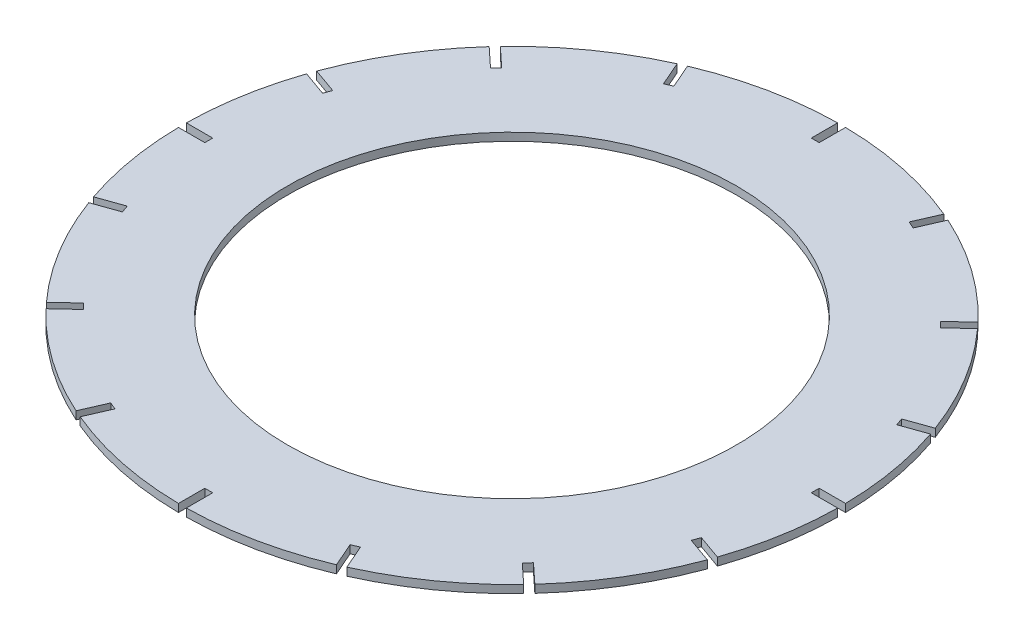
SolidWorks part; units mm, degrees
ref_plane "Front Plane" through (0, 0, 0) normal (0, 0, 1) x (1, 0, 0)
ref_plane "Top Plane" through (0, 0, 0) normal (0, 1, 0) x (1, 0, 0)
ref_plane "Right Plane" through (0, 0, 0) normal (1, 0, 0) x (0, 0, -1)
sketch "Sketch2" plane through (0, 0, 0) normal (0, 1, 0) x (1, 0, 0)
  line L0 (125, 0) -> (124.991, 0) construction
  line L1 (0, 125) -> (0, 124.991) construction
  line L2 (114.991, 1.5) -> (114.991, -1.5)
  line L3 (-124.991, 1.5) -> (-114.991, 1.5)
  line L5 (-124.991, -1.5) -> (-114.991, -1.5)
  line L6 (-114.991, 1.5) -> (-114.991, -1.5)
  line L7 (124.991, -1.5) -> (114.991, -1.5)
  line L9 (124.991, 1.5) -> (114.991, 1.5)
  line L23 (-117.2882, 43.2258) -> (-107.8644, 39.8805)
  line L24 (-118.2918, 40.3986) -> (-108.8679, 37.0534)
  line L25 (-107.8644, 39.8805) -> (-108.8679, 37.0534)
  line L26 (1.5, -124.991) -> (1.5, -114.991)
  line L28 (-1.5, 124.991) -> (-1.5, 114.991)
  line L29 (-1.5, 114.991) -> (1.5, 114.991)
  line L30 (1.5, 124.991) -> (1.5, 114.991)
  line L31 (-1.5, -114.991) -> (1.5, -114.991)
  line L32 (-1.5, -124.991) -> (-1.5, -114.991)
  line L35 (-90.574, 86.1473) -> (-83.2459, 79.3429)
  line L36 (-92.6153, 83.9488) -> (-85.2872, 77.1445)
  line L37 (-83.2459, 79.3429) -> (-85.2872, 77.1445)
  line L39 (-48.5996, 115.1655) -> (-44.6013, 105.9995)
  line L40 (-51.3493, 113.966) -> (-47.3511, 104.8001)
  line L41 (-44.6013, 105.9995) -> (-47.3511, 104.8001)
  line L42 (44.6013, 105.9995) -> (47.3511, 104.8001)
  line L43 (51.3493, 113.966) -> (47.3511, 104.8001)
  line L44 (48.5996, 115.1655) -> (44.6013, 105.9995)
  line L46 (83.2459, 79.3429) -> (85.2872, 77.1445)
  line L47 (92.6153, 83.9488) -> (85.2872, 77.1445)
  line L48 (90.574, 86.1473) -> (83.2459, 79.3429)
  line L50 (107.8644, 39.8805) -> (108.8679, 37.0534)
  line L51 (118.2918, 40.3986) -> (108.8679, 37.0534)
  line L52 (117.2882, 43.2258) -> (107.8644, 39.8805)
  line L55 (117.2882, -43.2258) -> (107.8644, -39.8805)
  line L56 (118.2918, -40.3986) -> (108.8679, -37.0534)
  line L57 (107.8644, -39.8805) -> (108.8679, -37.0534)
  line L59 (90.574, -86.1473) -> (83.2459, -79.3429)
  line L60 (92.6153, -83.9488) -> (85.2872, -77.1445)
  line L61 (83.2459, -79.3429) -> (85.2872, -77.1445)
  line L63 (48.5996, -115.1655) -> (44.6013, -105.9995)
  line L64 (51.3493, -113.966) -> (47.3511, -104.8001)
  line L65 (44.6013, -105.9995) -> (47.3511, -104.8001)
  line L66 (-44.6013, -105.9995) -> (-47.3511, -104.8001)
  line L67 (-51.3493, -113.966) -> (-47.3511, -104.8001)
  line L68 (-48.5996, -115.1655) -> (-44.6013, -105.9995)
  line L70 (-83.2459, -79.3429) -> (-85.2872, -77.1445)
  line L71 (-92.6153, -83.9488) -> (-85.2872, -77.1445)
  line L72 (-90.574, -86.1473) -> (-83.2459, -79.3429)
  line L74 (-107.8644, -39.8805) -> (-108.8679, -37.0534)
  line L75 (-118.2918, -40.3986) -> (-108.8679, -37.0534)
  line L76 (-117.2882, -43.2258) -> (-107.8644, -39.8805)
  line L78 (-124.991, 0) -> (-126.346, 0) construction
  line L79 (0, -114.991) -> (0, -125) construction
  arc A0 (-48.5996, -115.1655) -> (-1.5, -124.991) centre (0, 0) ccw
  arc A1 (-90.574, -86.1473) -> (-51.3493, -113.966) centre (0, 0) ccw
  arc A2 (-117.2882, -43.2258) -> (-92.6153, -83.9488) centre (0, 0) ccw
  arc A3 (-124.991, -1.5) -> (-118.2918, -40.3986) centre (0, 0) ccw
  arc A4 (-118.2918, 40.3986) -> (-124.991, 1.5) centre (0, 0) ccw
  arc A5 (-92.6153, 83.9488) -> (-117.2882, 43.2258) centre (0, 0) ccw
  arc A6 (-51.3493, 113.966) -> (-90.574, 86.1473) centre (0, 0) ccw
  arc A7 (-1.5, 124.991) -> (-48.5996, 115.1655) centre (0, 0) ccw
  arc A8 (48.5996, 115.1655) -> (1.5, 124.991) centre (0, 0) ccw
  arc A9 (90.574, 86.1473) -> (51.3493, 113.966) centre (0, 0) ccw
  arc A10 (117.2882, 43.2258) -> (92.6153, 83.9488) centre (0, 0) ccw
  arc A11 (124.991, 1.5) -> (118.2918, 40.3986) centre (0, 0) ccw
  arc A12 (1.5, -124.991) -> (48.5996, -115.1655) centre (0, 0) ccw
  arc A13 (51.3493, -113.966) -> (90.574, -86.1473) centre (0, 0) ccw
  arc A14 (92.6153, -83.9488) -> (117.2882, -43.2258) centre (0, 0) ccw
  arc A15 (118.2918, -40.3986) -> (124.991, -1.5) centre (0, 0) ccw
  dimension "D1" = 250
  dimension "D2" = 1.5
  dimension "D3" = 3
  dimension "D4" = 10
  dimension "D5" = 1.5
  dimension "D6" = 3
  dimension "D7" = 10
  dimension "D8" = 3
  dimension "D9" = 10
  dimension "D10" = 3
  dimension "D11" = 10
  dimension "D12" = 3
  dimension "D13" = 10
extrude "Boss-Extrude1" add sketch "Sketch2" along normal blind 3
sketch "Sketch3" plane through (0, 0, 0) normal (0, -1, 0) x (1, 0, 0)
  circle A0 centre (0, 0) radius 85.1272
  dimension "D1" = 170.2544
extrude "Cut-Extrude1" cut sketch "Sketch3" against normal blind 53.61
